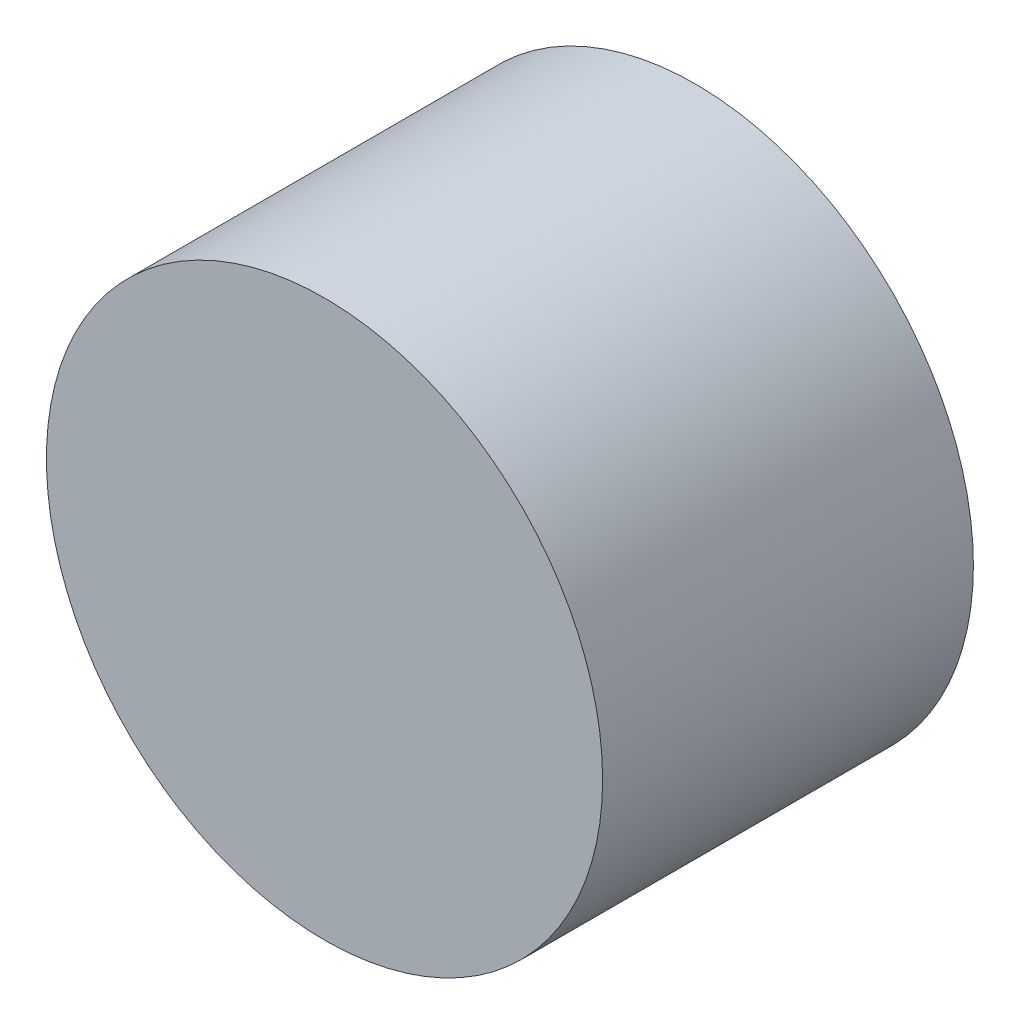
SolidWorks part; units mm, degrees
ref_plane "Front Plane" through (0, 0, 0) normal (0, 0, 1) x (1, 0, 0)
ref_plane "Top Plane" through (0, 0, 0) normal (0, 1, 0) x (1, 0, 0)
ref_plane "Right Plane" through (0, 0, 0) normal (1, 0, 0) x (0, 0, -1)
sketch "Sketch1" plane through (0, 0, 0) normal (0, 0, 1) x (1, 0, 0)
  circle A0 centre (0, 0) radius 38.1
  dimension "D1" = 76.2
extrude "Boss-Extrude1" add sketch "Sketch1" along normal mid plane 50.8
